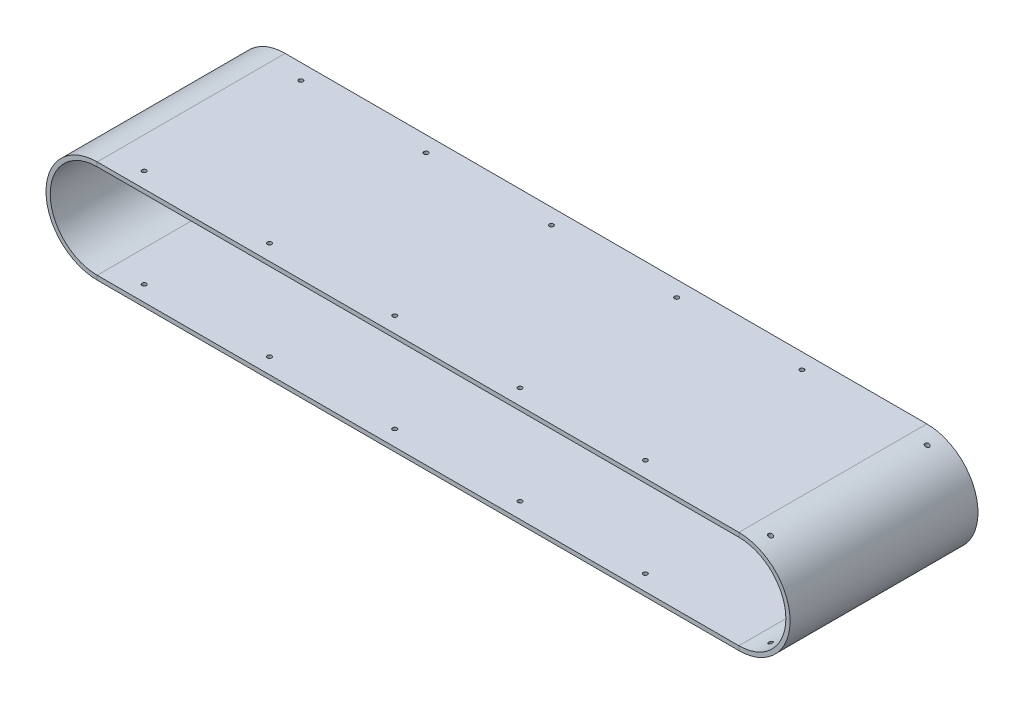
SolidWorks part; units mm, degrees
ref_plane "Front Plane" through (0, 0, 0) normal (0, 0, 1) x (1, 0, 0)
ref_plane "Top Plane" through (0, 0, 0) normal (0, 1, 0) x (1, 0, 0)
ref_plane "Right Plane" through (0, 0, 0) normal (1, 0, 0) x (0, 0, -1)
sketch "Sketch1" plane through (0, 0, 0) normal (0, 0, 1) x (1, 0, 0)
  line L0 (0, 39.8145) -> (520.371, 39.8145)
  line L1 (0, -39.8145) -> (520.371, -39.8145)
  line L2 (260.1855, 39.8145) -> (260.1855, -39.8145) construction
  arc A0 (0, 39.8145) -> (0, -39.8145) centre (0, 0) ccw
  arc A1 (520.371, 39.8145) -> (520.371, -39.8145) centre (520.371, 0) cw
sketch "Sketch2" plane through (0, 0, 0) normal (1, 0, 0) x (0, 0, -1)
  line L0 (0, 39.8145) -> (0, -39.8145) construction
  line L1 (-76.2, 38.1) -> (76.2, 38.1)
  line L2 (-76.2, 38.1) -> (-76.2, 41.529)
  line L3 (-76.2, 41.529) -> (76.2, 41.529)
  line L4 (76.2, 38.1) -> (76.2, 41.529)
  line L5 (-76.2, 38.1) -> (76.2, 41.529) construction
  line L6 (-76.2, 41.529) -> (76.2, 38.1) construction
  line L7 (0, 39.8145) -> (0, -39.8145) construction
  point P0 (0, 39.8145)
sweep "Sweep1" add profiles "Sketch2" path "Sketch1"
sketch "Sketch3" plane through (0, 41.529, 0) normal (0, 1, 0) x (1, 0, 0)
  line L0 (0, -63.5) -> (520.371, -63.5) construction
  line L1 (520.371, 76.2) -> (520.371, -76.2) construction
  line L2 (520.371, -76.2) -> (0, -76.2) construction
  line L3 (0, 76.2) -> (0, -76.2) construction
  line L4 (0, 0) -> (520.371, 0) construction
  circle A0 centre (25.4, -63.5) radius 1.75
  circle A1 centre (25.4, 63.5) radius 1.75
  circle A2 centre (127, -63.5) radius 1.75
  circle A3 centre (127, 63.5) radius 1.75
  circle A4 centre (228.6, -63.5) radius 1.75
  circle A5 centre (228.6, 63.5) radius 1.75
  circle A6 centre (330.2, -63.5) radius 1.75
  circle A7 centre (330.2, 63.5) radius 1.75
  circle A8 centre (431.8, -63.5) radius 1.75
  circle A9 centre (431.8, 63.5) radius 1.75
  circle A10 centre (533.4, -63.5) radius 1.75
  circle A11 centre (533.4, 63.5) radius 1.75
  dimension "D2" = 3.5
  dimension "D1" = 12.7
  dimension "D3" = 25.4
  dimension "D5" = 101.6
  dimension "D4" = 6
extrude "Cut-Extrude1" cut sketch "Sketch3" against normal through all
equation "\"D2@Sketch2\"=6in"
equation "\"32@Sketch1\"=1.5+0.135/2in"
